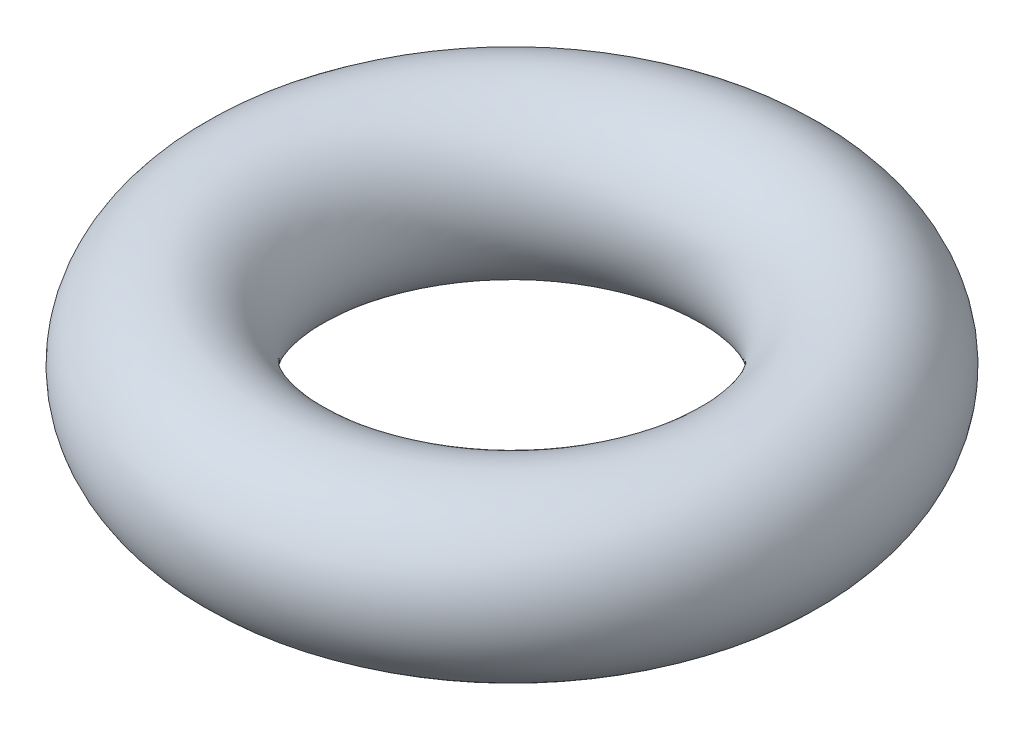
SolidWorks part; units mm, degrees
ref_plane "Plan1" through (0, 0, 0) normal (0, 0, 1) x (1, 0, 0)
ref_plane "Plan2" through (0, 0, 0) normal (0, 1, 0) x (1, 0, 0)
ref_plane "Plan3" through (0, 0, 0) normal (1, 0, 0) x (0, 0, -1)
sketch "Esquisse1" plane through (0, 0, 0) normal (0, 0, 1) x (1, 0, 0)
  line L0 (0, 0) -> (0, 1.5) construction
  circle A0 centre (4.5, 0) radius 1.5
  dimension "D2" = 3
  dimension "D1" = 4.5
  dimension "D3" = 1.5
revolve "Base-Révolution" add sketch "Esquisse1" angle 360 about L0
